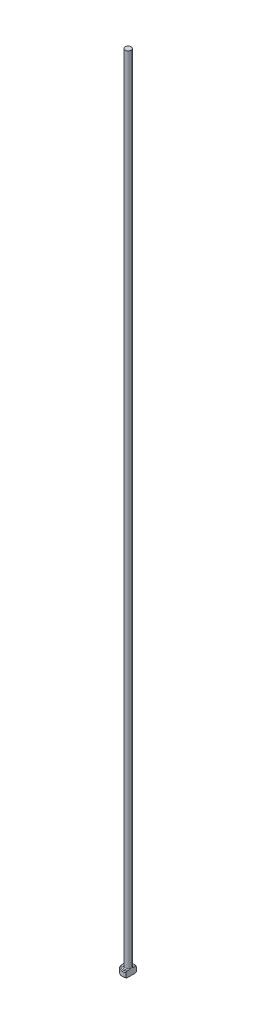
SolidWorks part; units mm, degrees
ref_plane "Front Plane" through (0, 0, 0) normal (0, 0, 1) x (1, 0, 0)
ref_plane "Top Plane" through (0, 0, 0) normal (0, 1, 0) x (1, 0, 0)
ref_plane "Right Plane" through (0, 0, 0) normal (1, 0, 0) x (0, 0, -1)
sketch "Sketch1" plane through (0, 0, 0) normal (0, 0, 1) x (1, 0, 0)
  line L0 (0, 259.9588) -> (0, -15.1925) construction
  line L1 (0, 0) -> (-1.5, 0)
  line L2 (-1.5, 0) -> (-1.5, 1.5)
  line L3 (-1.5, 1.5) -> (-0.75, 1.5)
  line L4 (-0.75, 1.5) -> (-0.75, 200)
  line L5 (-0.75, 200) -> (0, 200)
  line L6 (0, 200) -> (0, 0)
  dimension "L" = 200
  dimension "H" = 3
  dimension "T" = 1.5
  dimension "D" = 1.5
revolve "Revolve1" add sketch "Sketch1" angle 360 about L0
chamfer "Chamfer1" distance 0.2 angle 45 2 edges at (0, 1.5, 1.5) (0, 0, 1.5)
fillet "Fillet1" radius 0.2 1 edges at (0, 1.5, 0.75)
sketch "Sketch2" plane through (0, 0, 0) normal (0, 1, 0) x (1, 0, 0)
  line L0 (0.75, 1.299) -> (0.75, -1.299)
  circle A0 centre (0, 0) radius 1.5 construction
  arc A1 (0.75, -1.299) -> (0.75, 1.299) centre (0, 0) ccw
  circle A2 centre (0, 0) radius 0.75 construction
extrude "KEY" cut sketch "Sketch2" along normal through all
